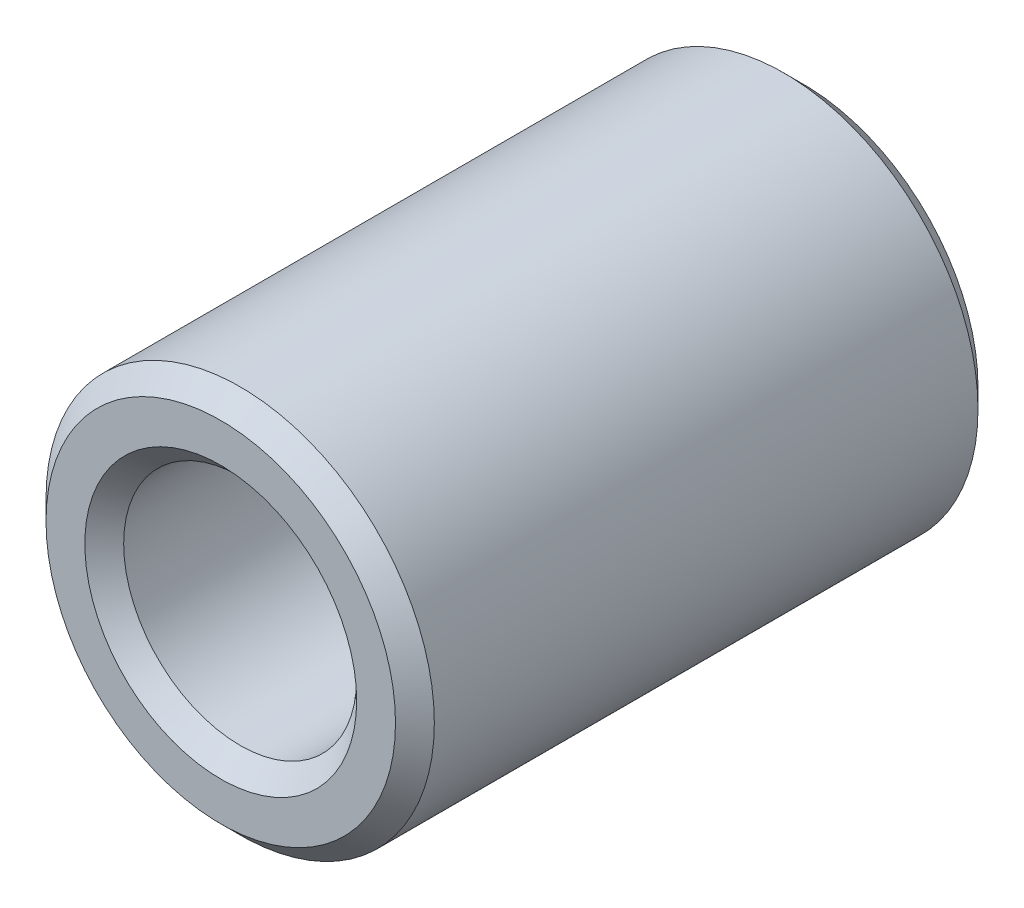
SolidWorks part; units mm, degrees
ref_plane "XY" through (0, 0, 0) normal (0, 0, 1) x (1, 0, 0)
ref_plane "XZ" through (0, 0, 0) normal (0, 1, 0) x (1, 0, 0)
ref_plane "YZ" through (0, 0, 0) normal (1, 0, 0) x (0, 0, -1)
sketch "Esquisse1" plane through (0, 0, 0) normal (0, 0, 1) x (1, 0, 0)
  circle A0 centre (0, 0) radius 5
  circle A1 centre (0, 0) radius 3
  dimension "D1" = 10
  dimension "D2" = 6
extrude "Corps" add sketch "Esquisse1" against normal blind 15
chamfer "Chanf" distance 0.5 angle 45
